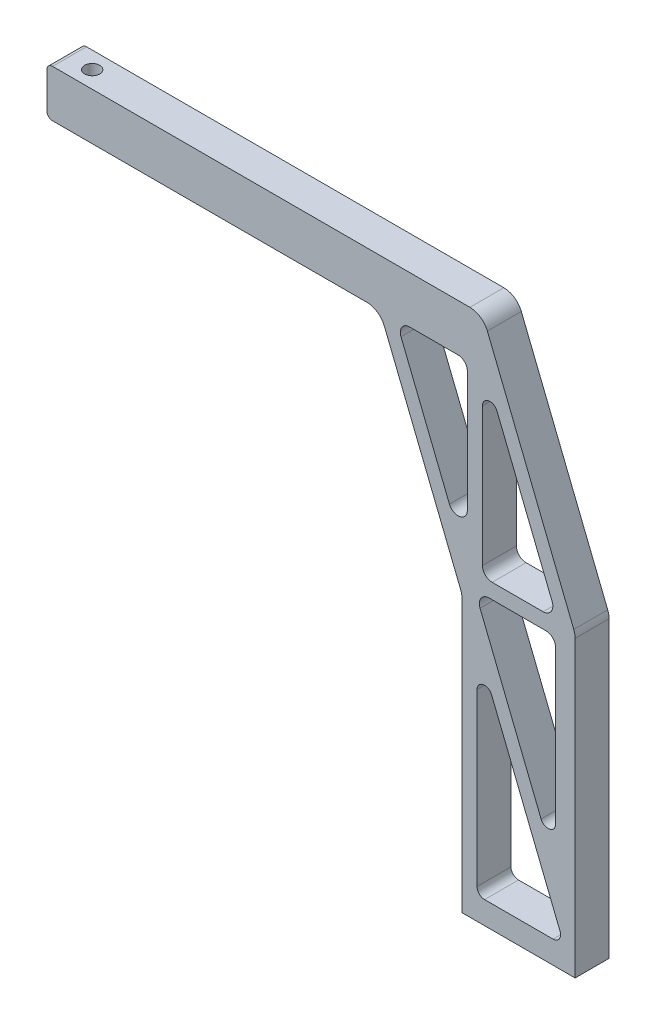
SolidWorks part; units mm, degrees
ref_plane "Front Plane" through (0, 0, 0) normal (0, 0, 1) x (1, 0, 0)
ref_plane "Top Plane" through (0, 0, 0) normal (0, 1, 0) x (1, 0, 0)
ref_plane "Right Plane" through (0, 0, 0) normal (1, 0, 0) x (0, 0, -1)
sketch "Sketch1" plane through (0, 0, 0) normal (0, 0, 1) x (1, 0, 0)
  line L0 (0, 0) -> (60, 0)
  line L1 (55, 0) -> (-55, 0) construction
  line L2 (60, 0) -> (60, 155.9278)
  line L3 (8, 16) -> (8, 106.3908)
  line L4 (0, -55) -> (0, 55) construction
  line L5 (4.205, 280) -> (-217, 280)
  line L6 (-220, 277) -> (-220, 258)
  line L7 (-217, 255) -> (-50.413, 255)
  line L8 (0, 144.3339) -> (0, 100.7364)
  line L9 (0, 100.7364) -> (0, 0)
  line L10 (-41.1329, 248.7256) -> (-0.7199, 148.0594)
  line L11 (13.4851, 273.7256) -> (59.2801, 159.6534)
  line L13 (15.712, 107.8811) -> (52, 17.4902)
  line L15 (48.288, 12) -> (12, 12)
  line L16 (9.6019, 144.5744) -> (41.9512, 63.9944)
  line L18 (49.6632, 65.4846) -> (49.6632, 146.4959)
  line L19 (44.5057, 151.6534) -> (14.3881, 151.6534)
  line L22 (16.0133, 159.6534) -> (43.0314, 159.6534)
  line L23 (47.8176, 166.7324) -> (18.5678, 239.5917)
  line L25 (10.8557, 238.1015) -> (10.8557, 164.8109)
  line L26 (2.8557, 186.0734) -> (2.8557, 250.0827)
  line L27 (-27.7585, 255) -> (-2.0615, 255)
  line L28 (-32.3217, 248.2508) -> (-6.6248, 184.2415)
  arc A0 (0, 144.3339) -> (-0.7199, 148.0594) centre (-10, 144.3339) ccw
  arc A1 (-50.413, 255) -> (-41.1329, 248.7256) centre (-50.413, 245) cw
  arc A2 (60, 155.9278) -> (59.2801, 159.6534) centre (50, 155.9278) ccw
  arc A3 (4.205, 280) -> (13.4851, 273.7256) centre (4.205, 270) cw
  arc A4 (-220, 258) -> (-217, 255) centre (-217, 258) ccw
  arc A5 (-217, 280) -> (-220, 277) centre (-217, 277) ccw
  arc A6 (8, 16) -> (12, 12) centre (12, 16) ccw
  arc A7 (52, 17.4902) -> (48.288, 12) centre (48.288, 16) cw
  arc A8 (41.9512, 63.9944) -> (49.6632, 65.4846) centre (45.6632, 65.4846) ccw
  arc A9 (8, 106.3908) -> (15.712, 107.8811) centre (12, 106.3908) cw
  arc A10 (10.8557, 238.1015) -> (18.5678, 239.5917) centre (14.8557, 238.1015) cw
  arc A11 (49.6632, 146.4959) -> (44.5057, 151.6534) centre (44.5057, 146.4959) ccw
  arc A12 (14.3881, 151.6534) -> (9.6019, 144.5744) centre (14.3881, 146.4959) ccw
  arc A13 (10.8557, 164.8109) -> (16.0133, 159.6534) centre (16.0133, 164.8109) ccw
  arc A14 (43.0314, 159.6534) -> (47.8176, 166.7324) centre (43.0314, 164.8109) ccw
  arc A16 (2.8557, 186.0734) -> (-6.6248, 184.2415) centre (-2.0615, 186.0734) cw
  arc A17 (2.8557, 250.0827) -> (-2.0615, 255) centre (-2.0615, 250.0827) ccw
  arc A18 (-27.7585, 255) -> (-32.3217, 248.2508) centre (-27.7585, 250.0827) ccw
  point P24 (-220, 255)
  point P27 (-220, 280)
  dimension "D5" = 10
  dimension "D6" = 10
  dimension "D7" = 3
  dimension "D19" = 4
  dimension "D17" = 4
  dimension "D1" = 60
  dimension "D2" = 280
  dimension "D3" = 25
  dimension "D4" = 220
  dimension "D8" = 8
  dimension "D9" = 8
  dimension "D10" = 8
  dimension "D11" = 10.3368
  dimension "D12" = 12
  dimension "D13" = 8
  dimension "D14" = 8
  dimension "D15" = 8
  dimension "D16" = 8
  dimension "D18" = 60
extrude "Boss-Extrude1" add sketch "Sketch1" along normal blind 18
sketch "Sketch2" plane through (0, 280, 0) normal (0, 1, 0) x (1, 0, 0)
  line L0 (-220, -18) -> (-220, 0) construction
  line L1 (-55, 0) -> (55, 0) construction
  circle A0 centre (-205, -9) radius 4
  dimension "D1" = 8
  dimension "D2" = 15
  dimension "D3" = 9
extrude "Cut-Extrude1" cut sketch "Sketch2" against normal up to next
